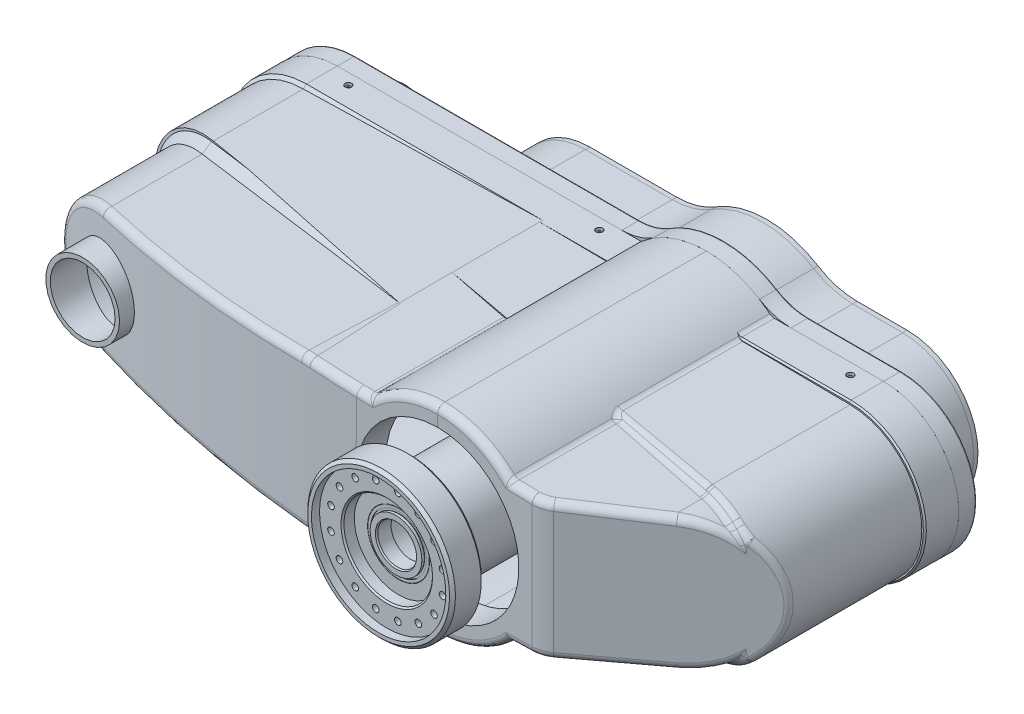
SolidWorks part; units mm, degrees
ref_plane "前视基准面" through (0, 0, 0) normal (0, 0, 1) x (1, 0, 0)
ref_plane "上视基准面" through (0, 0, 0) normal (0, 1, 0) x (1, 0, 0)
ref_plane "右视基准面" through (0, 0, 0) normal (1, 0, 0) x (0, 0, -1)
imported_body "STG030-250(机加工)-1/STG030315-1-surface1"
imported_body "STG030-250(机加工)-1/STG030315-1-surface2"
imported_body "STG030-250(机加工)-1/STG030315-1-surface3"
imported_body "STG030-250(机加工)-1/STG030315-1-surface4"
imported_body "STG030-250(机加工)-1/STG030315-1-surface5"
imported_body "STG030-250(机加工)-1/STG030315-1-surface6"
imported_body "STG030-250(机加工)-1/STG030304-1-surface1"
imported_body "STG030-250(机加工)-1/RBS2020-1/2020_0002_1-1-surface1"
imported_body "STG030-250(机加工)-1/STG030409-1-surface1"
imported_body "STG030-250(机加工)-1/STG030303-1-surface1"
imported_body "STG030-250(机加工)-1/STG030303-1-surface2"
imported_body "STG030-250(机加工)-1/STG030303-1-surface3"
imported_body "STG030-250(机加工)-1/KQ2LE06弯头-1-surface1"
imported_body "STG030-250(机加工)-1/S16-ZV-1-surface1"
imported_body "STG030-250(机加工)-1/S16-ZV-1-surface2"
imported_body "STG030-250(机加工)-1/STG030410-1-surface1"
imported_body "STG030-250(机加工)-1/KQ2LE06弯头-2-surface1"
imported_body "STG030-250(机加工)-1/KQ2LE06弯头-2-surface2"
imported_body "STG030-250(机加工)-1/KQ2LE06弯头-3-surface1"
imported_body "X臂-2/STG030301-1-surface1"
imported_body "X臂-2/GB／T276-94深沟球轴承61806-2Z-2-surface1"
imported_body "X臂-2/GB／T276-94深沟球轴承61806-2Z-2-surface2"
sketch "草图1" plane through (-0.5737, -45.897, 0) normal (-0.0125, -0.9999, 0) x (0.9999, -0.0125, 0)
  point P0 (-695.9598, -370.2999)
sketch_block_instance "TURIN-LOGO-1"
sketch_block "TURIN-LOGO"
extrude "凸台-拉伸1" add sketch "草图1" along normal blind 0.1
